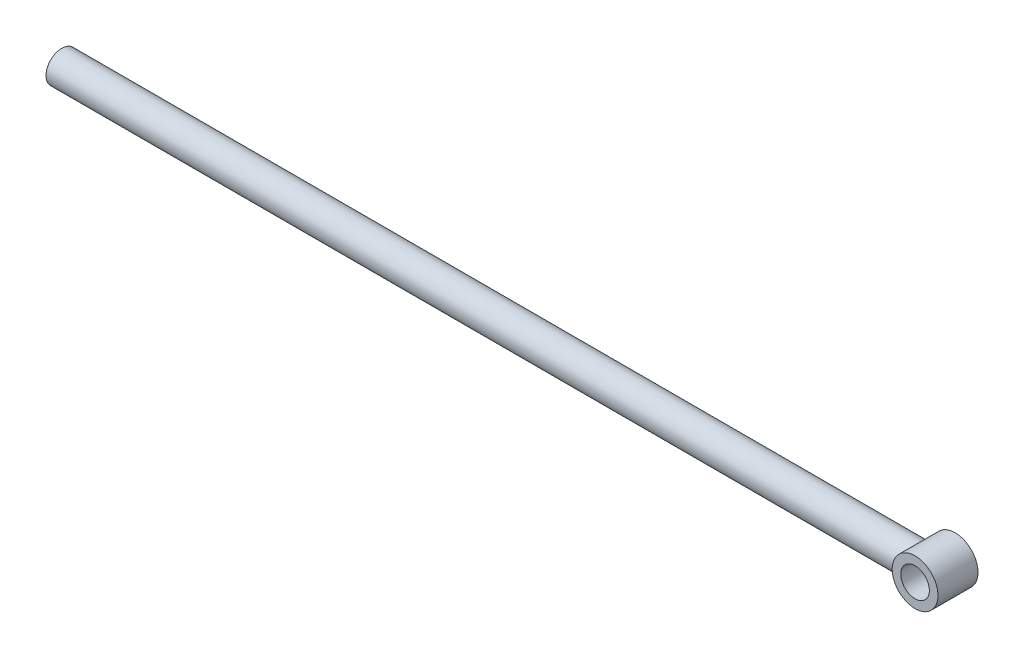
SolidWorks part; units mm, degrees
ref_plane "Face" through (0, 0, 0) normal (0, 0, 1) x (1, 0, 0)
ref_plane "Dessus" through (0, 0, 0) normal (0, 1, 0) x (1, 0, 0)
ref_plane "Droite" through (0, 0, 0) normal (1, 0, 0) x (0, 0, -1)
sketch "Esquisse1" plane through (0, 0, 0) normal (0, 0, 1) x (1, 0, 0)
  line L0 (50, 0) -> (-50, 0) construction
  circle A1 centre (282.8393, 0) radius 8
  circle A3 centre (282.8393, 0) radius 5
  dimension "D3" = 16
  dimension "D4" = 10
extrude "Extrusion1" add sketch "Esquisse1" along normal blind 14
sketch "Esquisse3" plane through (0, 0, 0) normal (0, 1, 0) x (1, 0, 0)
  line L0 (-116.6346, -7) -> (271.0658, -7) construction
  line L1 (-22.5465, -4.5) -> (277.4535, -4.5)
  line L2 (-22.5465, -1.5) -> (277.4535, -1.5)
  line L3 (-22.5465, -1.5) -> (-22.5465, -4.5)
  line L4 (277.4535, -1.5) -> (277.4535, -4.5)
  line L6 (287.8393, 0) -> (277.8393, 0) construction
  dimension "D1" = 5
  dimension "D2" = 3
  dimension "D3" = 7
  dimension "D4" = 300
revolve "Révolution3" add sketch "Esquisse3" angle 360 about L0
